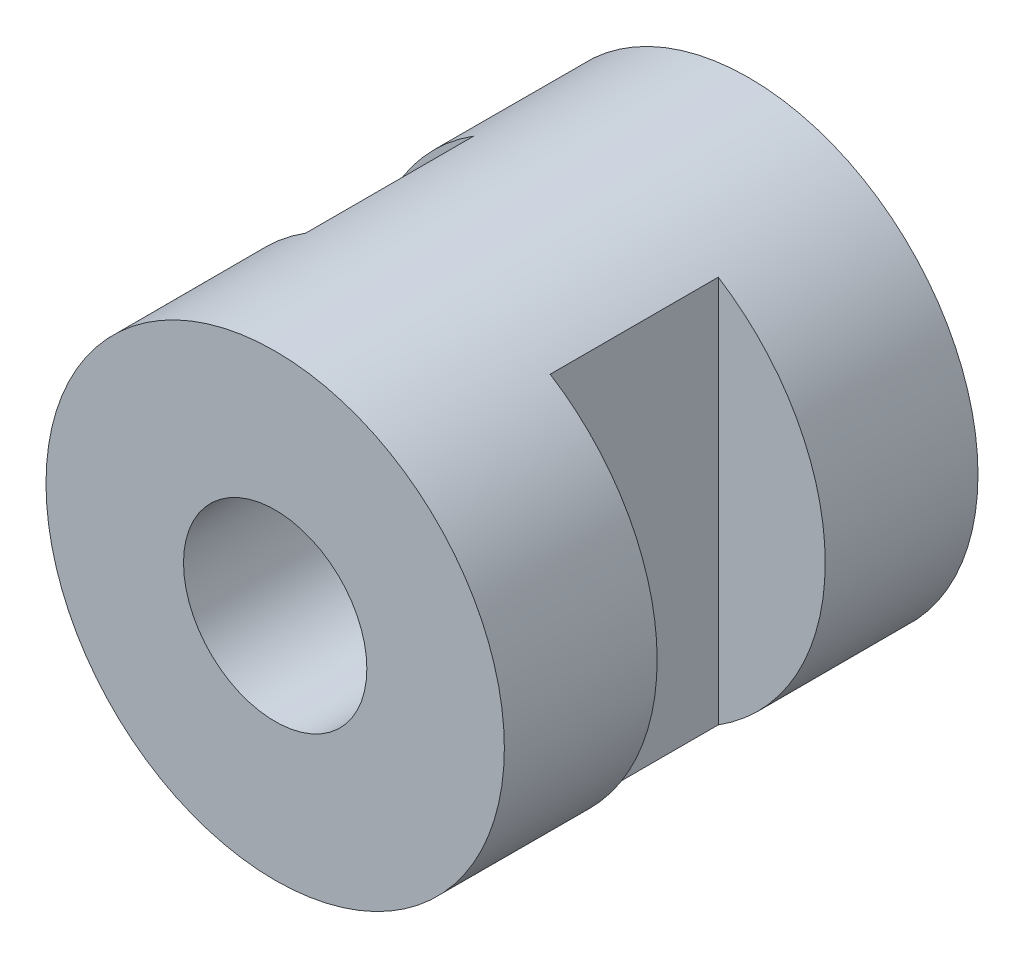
SolidWorks part; units mm, degrees
ref_plane "前视基准面" through (0, 0, 0) normal (0, 0, 1) x (1, 0, 0)
ref_plane "上视基准面" through (0, 0, 0) normal (0, 1, 0) x (1, 0, 0)
ref_plane "右视基准面" through (0, 0, 0) normal (1, 0, 0) x (0, 0, -1)
sketch "草图1" plane through (0, 0, 0) normal (0, 0, 1) x (1, 0, 0)
  circle A0 centre (0, 0) radius 7.5
extrude "凸台-拉伸1" add sketch "草图1" along normal blind 15.5
ref_plane "基准面1" through (0, 10, 0) normal (0, 1, 0) x (-1, 0, 0)
sketch "草图2" plane through (0, 10, 0) normal (0, 1, 0) x (-1, 0, 0)
  line L0 (-7.5, 15.5) -> (-7.5, 0) construction
  line L1 (-8.7534, 10.5) -> (-4, 10.5)
  line L2 (-8.7534, 10.5) -> (-8.7534, 5)
  line L3 (-8.7534, 5) -> (-4, 5)
  line L4 (-4, 10.5) -> (-4, 5)
  line L5 (0, 15.5) -> (0, 0) construction
  line L6 (7.5, 15.5) -> (-7.5, 15.5) construction
  line L7 (0, 7.75) -> (7.9583, 7.75) construction
  line L8 (8.7534, 5) -> (4, 5)
  line L9 (8.7534, 10.5) -> (8.7534, 5)
  line L10 (4, 10.5) -> (4, 5)
  line L11 (8.7534, 10.5) -> (4, 10.5)
  dimension "D1" = 3.5
  dimension "D2" = 5.5
extrude "切除-拉伸1" cut sketch "草图2" against normal through all
sketch "草图3" plane through (0, 0, 0) normal (0, 0, -1) x (-1, 0, 0)
  circle A0 centre (0, 0) radius 3
extrude "切除-拉伸2" cut sketch "草图3" against normal blind 15.5
